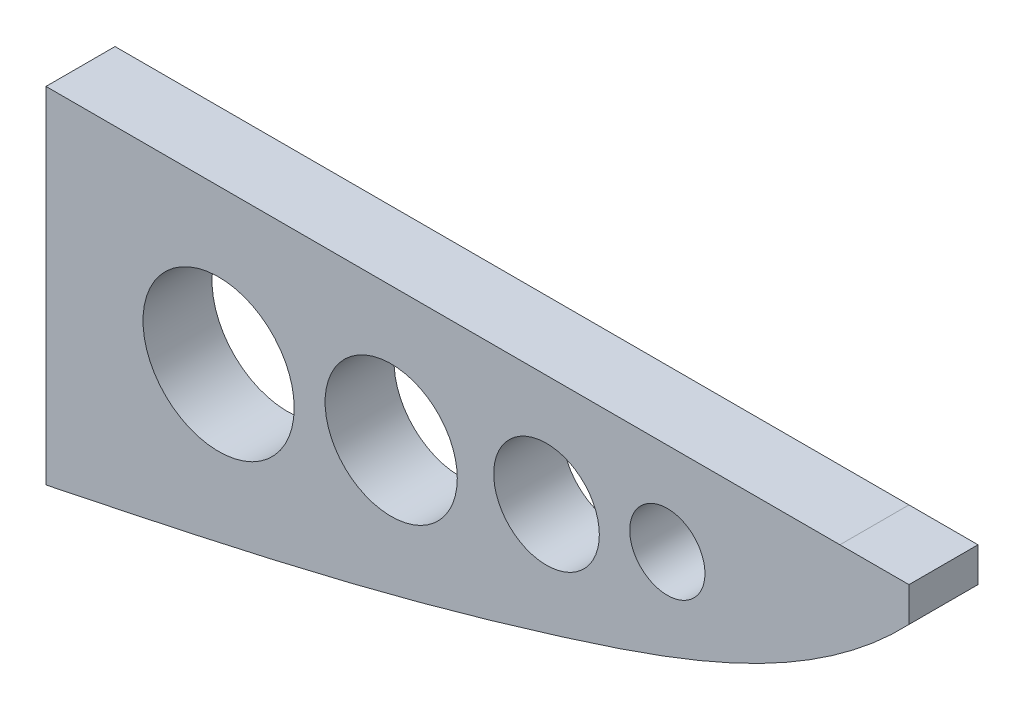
SolidWorks part; units mm, degrees
ref_plane "Ebene vorne" through (0, 0, 0) normal (0, 0, 1) x (1, 0, 0)
ref_plane "Ebene oben" through (0, 0, 0) normal (0, 1, 0) x (1, 0, 0)
ref_plane "Ebene rechts" through (0, 0, 0) normal (1, 0, 0) x (0, 0, -1)
sketch "Skizze1" plane through (0, 0, 0) normal (0, 0, 1) x (1, 0, 0)
  line L0 (0, 0) -> (94.8472, 0) construction
  line L1 (0, -50) -> (0, 50)
  line L2 (0, 50) -> (250, 50)
  line L3 (50, 50) -> (50, -39.4)
  line L4 (100, 50) -> (100, -27.5)
  line L5 (150, 50) -> (150, -13.2)
  line L6 (200, 50) -> (200, 5.3)
  line L7 (250, 50) -> (250, 40)
  spline S0 degree 3 poles (0, -50) (33.4199, -43.0609) (83.9633, -32.5542) (169.944, -7.8832) (222.6154, 11.3744) (250, 40) knots 0 0 0 0 0.381515 0.575066 1 1 1 1
  point P14 (-115.2196, 98.0463)
  point P20 (200, 27.65)
  point P21 (150, 18.4)
  point P22 (100, 11.25)
  point P23 (50, 5.3)
  dimension "D1" = 100
  dimension "D2" = 50
  dimension "D3" = 250
  dimension "D4" = 50
  dimension "D5" = 50
  dimension "D6" = 50
  dimension "D7" = 50
  dimension "D8" = 89.4
  dimension "D9" = 77.5
  dimension "D10" = 63.2
  dimension "D11" = 44.7
  dimension "D12" = 10
extrude "Aufsatz-Linear austragen1" add sketch "Skizze1" along normal blind 20 contours L1 L2 L7 S0
sketch "Skizze2" plane through (0, 50, 0) normal (0, 1, 0) x (1, 0, 0)
  line L0 (230, -20) -> (230, 0)
  line L1 (0, -20) -> (250, -20) construction
  line L2 (0, 0) -> (250, 0) construction
  line L3 (250, -20) -> (250, 0) construction
  dimension "D1" = 20
sketch "Skizze3" plane through (0, 0, 20) normal (0, 0, 1) x (1, 0, 0)
  line L0 (250, 50) -> (250, 40) construction
  line L2 (0, 50) -> (230, 50) construction
  circle A0 centre (145, 17.6605) radius 15.3
  circle A1 centre (180, 23.2226) radius 10.9
  circle A2 centre (100, 11.25) radius 19.15
  circle A3 centre (50, 5.3) radius 21.9
  point P14 (50, 5.3)
  point P15 (100, 11.25)
  point P16 (150, 18.4)
  point P17 (200, 27.65)
  dimension "D5" = 21.8
  dimension "D6" = 105
  dimension "D7" = 38.3
  dimension "D8" = 43.8
  dimension "D2" = 30.6
  dimension "D3" = 150
  dimension "D4" = 200
  dimension "D11" = 70
  dimension "D13" = 38.75
  dimension "D14" = 44.7
extrude "Schnitt-Linear austragen1" cut sketch "Skizze3" against normal through all
